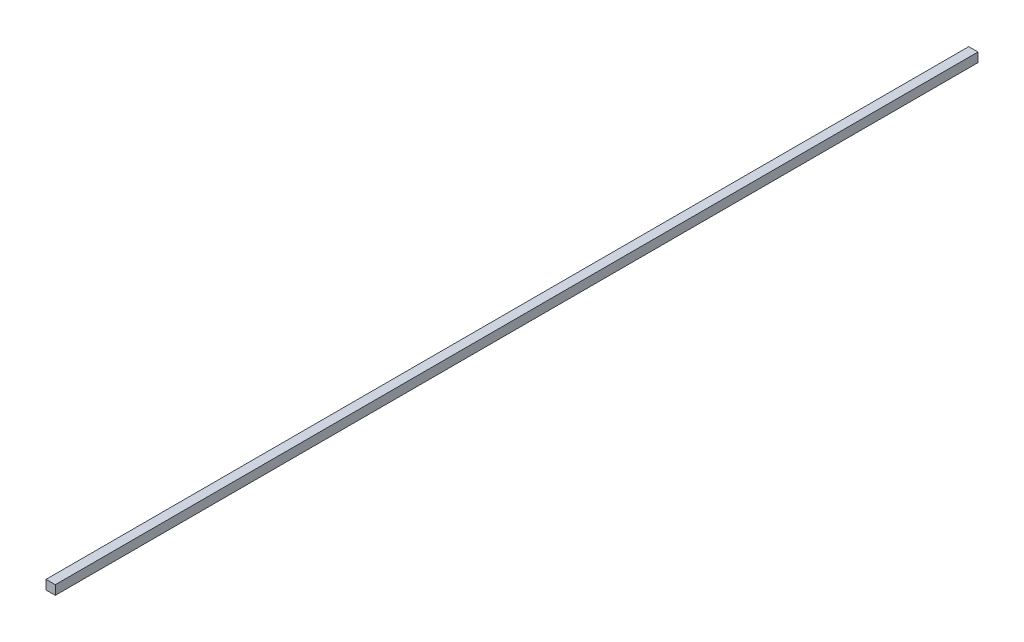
SolidWorks part; units mm, degrees
ref_plane "Front Plane" through (0, 0, 0) normal (0, 0, 1) x (1, 0, 0)
ref_plane "Top Plane" through (0, 0, 0) normal (0, 1, 0) x (1, 0, 0)
ref_plane "Right Plane" through (0, 0, 0) normal (1, 0, 0) x (0, 0, -1)
sketch "Sketch1" plane through (0, 0, 0) normal (0, 0, 1) x (1, 0, 0)
  line L0 (0, 0) -> (0, 4.7625)
  line L1 (0, 0) -> (4.7625, 0)
  line L2 (0, 4.7625) -> (4.7625, 4.7625)
  line L3 (4.7625, 0) -> (4.7625, 4.7625)
  dimension "D1" = 4.7625
  dimension "D2" = 4.7625
extrude "Boss-Extrude1" add sketch "Sketch1" along normal blind 474.389
